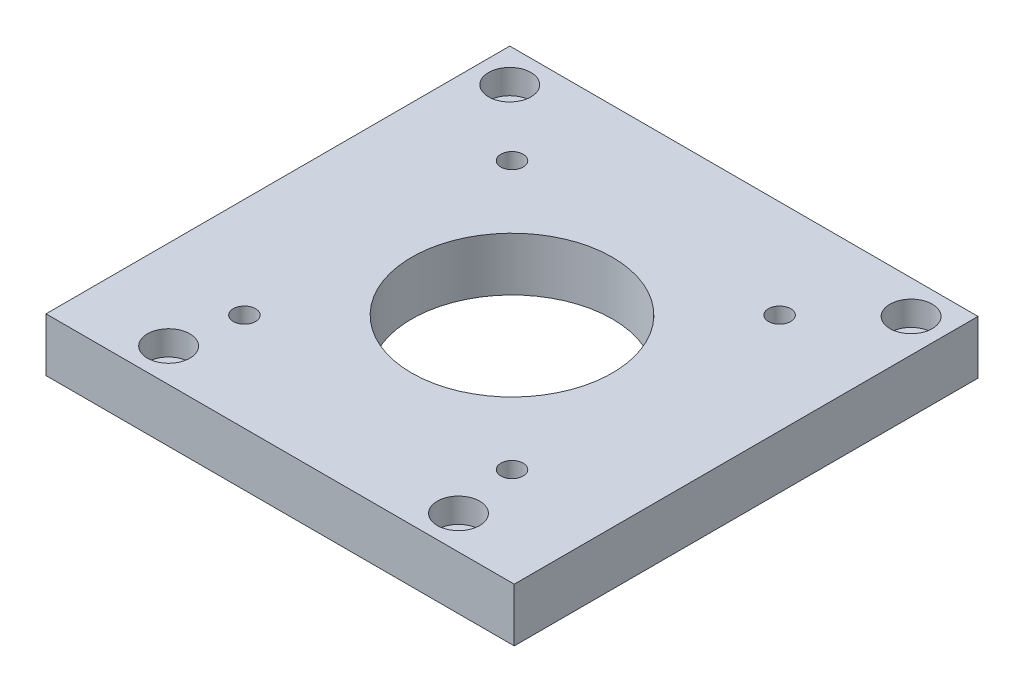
SolidWorks part; units mm, degrees
ref_plane "前视基准面" through (0, 0, 0) normal (0, 0, 1) x (1, 0, 0)
ref_plane "上视基准面" through (0, 0, 0) normal (0, 1, 0) x (1, 0, 0)
ref_plane "右视基准面" through (0, 0, 0) normal (1, 0, 0) x (0, 0, -1)
sketch "草图1" plane through (0, 0, 0) normal (0, 0, 1) x (1, 0, 0)
  line L0 (0, 0) -> (105, 0)
  line L1 (0, 12) -> (105, 12)
  line L2 (105, 0) -> (105, 12)
  line L3 (0, 0) -> (0, 12)
extrude "凸台-拉伸1" add sketch "草图1" along normal blind 104
sketch "草图2" plane through (0, 12, 0) normal (0, 1, 0) x (1, 0, 0)
  circle A0 centre (7.5, -7.5) radius 2.75
  circle A1 centre (97.5, -7.5) radius 2.75
  circle A2 centre (85, -96.5) radius 2.75
  circle A3 centre (20, -96.5) radius 2.75
  circle A4 centre (52.5, -52) radius 22.5
  circle A5 centre (22.5, -22) radius 2.5
  circle A6 centre (82.5, -22) radius 2.5
  circle A7 centre (82.5, -82) radius 2.5
  circle A8 centre (22.5, -82) radius 2.5
extrude "切除-拉伸1" cut sketch "草图2" against normal blind 104
sketch "草图3" plane through (0, 12, 0) normal (0, 1, 0) x (1, 0, 0)
  circle A0 centre (7.5, -7.5) radius 4.75
  circle A1 centre (97.5, -7.5) radius 4.75
  circle A2 centre (85, -96.5) radius 4.75
  circle A3 centre (20, -96.5) radius 4.75
extrude "切除-拉伸2" cut sketch "草图3" against normal blind 5.5
